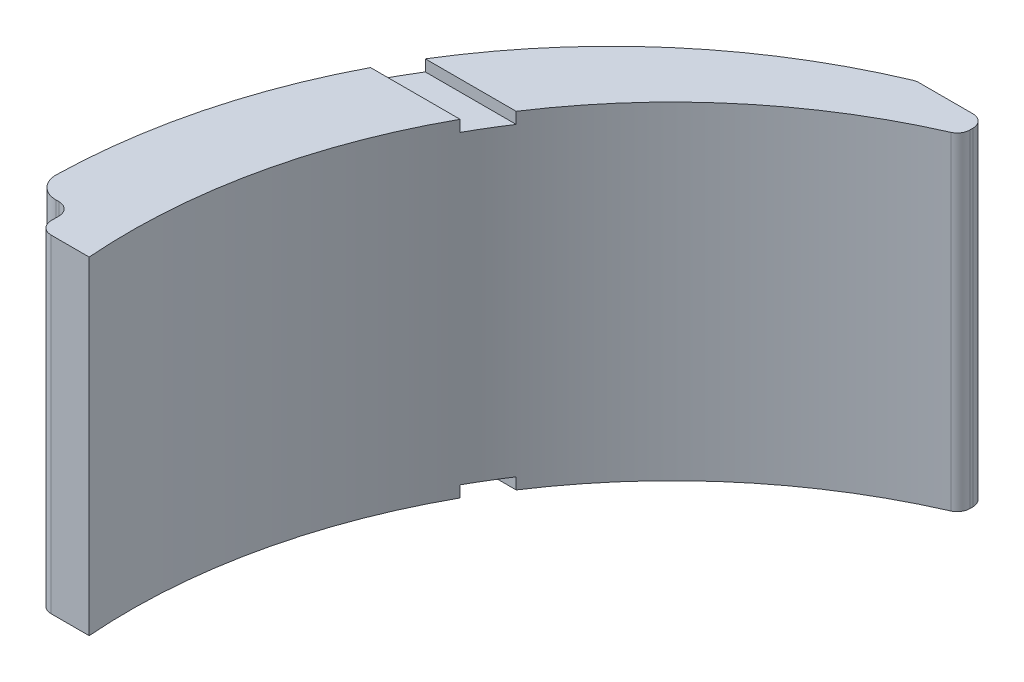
SolidWorks part; units mm, degrees
ref_plane "前视基准面" through (0, 0, 0) normal (0, 0, 1) x (1, 0, 0)
ref_plane "上视基准面" through (0, 0, 0) normal (0, 1, 0) x (1, 0, 0)
ref_plane "右视基准面" through (0, 0, 0) normal (1, 0, 0) x (0, 0, -1)
sketch "Sketch1" plane through (0, 0, 0) normal (0, 1, 0) x (1, 0, 0)
  line L0 (114.1074, 136.0607) -> (126.1074, 136.0607) construction
  line L7 (127.9788, 161.2873) -> (130.1224, 161.2873)
  line L11 (130.6224, 160.7873) -> (130.6224, 160.6701)
  line L12 (117.5287, 138.8529) -> (116.0234, 138.8529)
  line L13 (114.9033, 140.1565) -> (115.0234, 140.1565)
  line L14 (115.5234, 139.6565) -> (115.5234, 139.3529)
  line L15 (117.3873, 152.3197) -> (120.9878, 152.3197) construction
  line L16 (116.6004, 150.9337) -> (120.1513, 150.9337) construction
  arc A39 (130.3233, 160.2122) -> (117.5287, 138.8529) centre (138.9636, 140.5248) ccw
  arc A40 (127.7841, 161.2478) -> (114.0535, 141.0255) centre (136.5479, 140.5248) ccw
  arc A41 (130.6224, 160.6701) -> (130.3233, 160.2122) centre (130.1224, 160.6701) cw
  arc A42 (130.6224, 160.7873) -> (130.1224, 161.2873) centre (130.1224, 160.7873) ccw
  arc A43 (127.9788, 161.2873) -> (127.7841, 161.2478) centre (127.9788, 160.7873) ccw
  arc A44 (115.5234, 139.6565) -> (115.0234, 140.1565) centre (115.0234, 139.6565) ccw
  arc A45 (116.0234, 138.8529) -> (115.5234, 139.3529) centre (116.0234, 139.3529) cw
  arc A46 (114.0535, 141.0255) -> (114.9033, 140.1565) centre (114.9033, 141.0065) ccw
  dimension "D1" = 12
extrude "Boss-Extrude1" add sketch "Sketch1" along normal blind 13
sketch "Sketch8" plane through (0, 0, 0) normal (0, 1, 0) x (1, 0, 0)
  line L0 (114.1074, 136.0607) -> (126.1074, 136.0607) construction
  line L15 (117.3873, 152.3197) -> (120.9878, 152.3197)
  line L16 (116.6004, 150.9337) -> (120.1513, 150.9337)
  arc A39 (120.9878, 152.3197) -> (120.1513, 150.9337) centre (138.9636, 140.5248) ccw
  arc A40 (117.3873, 152.3197) -> (116.6004, 150.9337) centre (136.5479, 140.5248) ccw
  dimension "D1" = 12
extrude "Cut-Extrude3" cut sketch "Sketch8" along normal blind 0.45
ref_plane "Plane1" through (0, 6.5, 0) normal (0, -1, 0) x (-1, 0, 0)
mirror "Mirror1" about plane through (0, 6.5, 0) normal (0, -1, 0) of "Cut-Extrude3"
